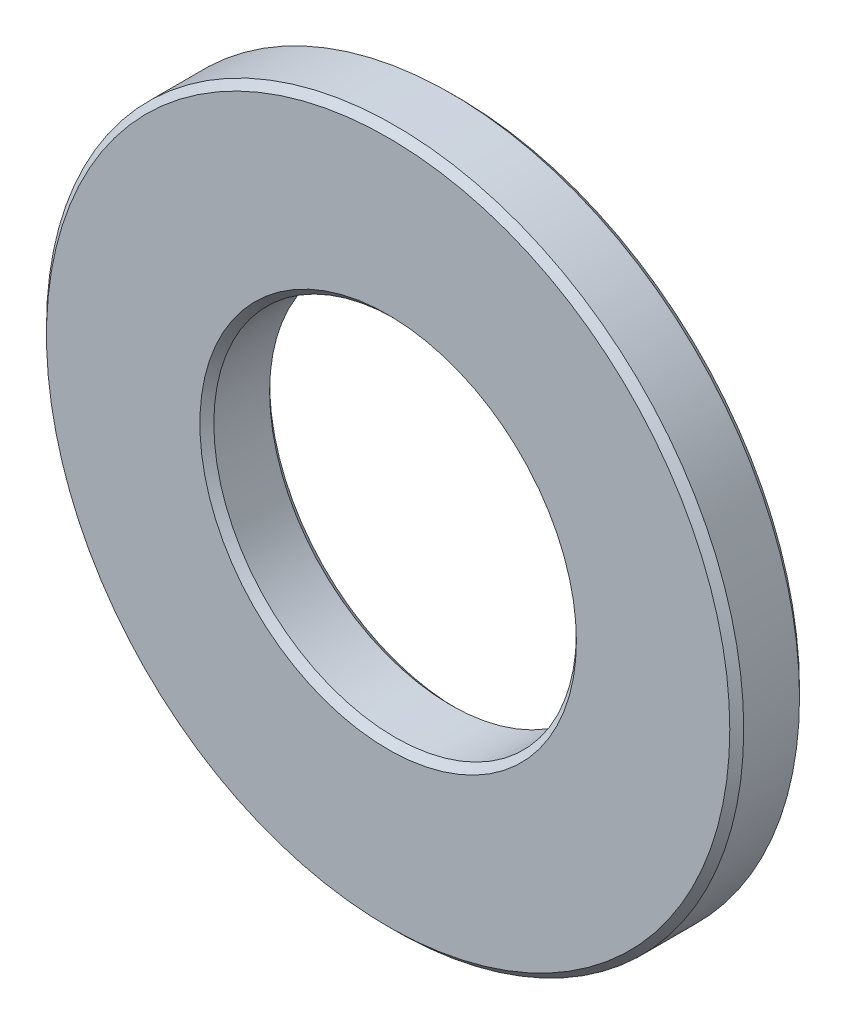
SolidWorks part; units mm, degrees
ref_plane "Front Plane" through (0, 0, 0) normal (0, 0, 1) x (1, 0, 0)
ref_plane "Top Plane" through (0, 0, 0) normal (0, 1, 0) x (1, 0, 0)
ref_plane "Right Plane" through (0, 0, 0) normal (1, 0, 0) x (0, 0, -1)
sketch "Sketch1" plane through (0, 0, 0) normal (0, 0, 1) x (1, 0, 0)
  circle A0 centre (0, 0) radius 5
  circle A1 centre (0, 0) radius 2.6
  dimension "D1" = 10
  dimension "D2" = 5.2
extrude "Boss-Extrude2" add sketch "Sketch1" along normal mid plane 1
chamfer "Chamfer3" distance 0.1 angle 45 4 edges at (5, 0, 0.5) (5, 0, -0.5) (2.6, 0, -0.5) (2.6, 0, 0.5)
